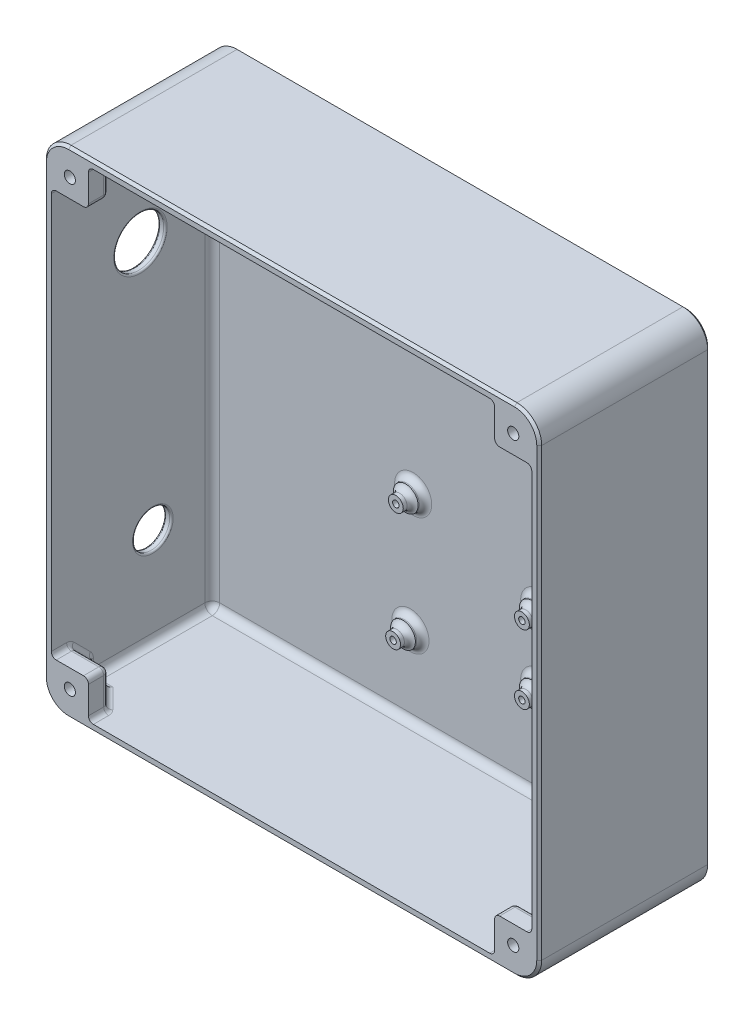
SolidWorks part; units mm, degrees
ref_plane "Ebene vorne" through (0, 0, 0) normal (0, 0, 1) x (1, 0, 0)
ref_plane "Ebene oben" through (0, 0, 0) normal (0, 1, 0) x (1, 0, 0)
ref_plane "Ebene rechts" through (0, 0, 0) normal (1, 0, 0) x (0, 0, -1)
sketch "Skizze1" plane through (0, 0, 0) normal (0, 0, 1) x (1, 0, 0)
  line L1 (-100, 100) -> (100, 100)
  line L2 (-100, 100) -> (-100, -100)
  line L3 (-100, -100) -> (100, -100)
  line L4 (100, 100) -> (100, -100)
  line L5 (-100, 100) -> (100, -100) construction
  line L6 (-100, -100) -> (100, 100) construction
  point P0 (0, 0)
  dimension "D1" = 200
  dimension "D2" = 200
extrude "Aufsatz-Linear austragen1" add sketch "Skizze1" along normal blind 4
sketch "Skizze2" plane through (0, 0, 4) normal (0, 0, 1) x (1, 0, 0)
  line L1 (-100, 100) -> (100, 100)
  line L2 (-100, 100) -> (-100, -100)
  line L3 (-100, -100) -> (100, -100)
  line L4 (100, 100) -> (100, -100)
  line L5 (-100, 100) -> (100, -100) construction
  line L6 (-100, -100) -> (100, 100) construction
  line L7 (-97, 97) -> (97, 97)
  line L8 (-97, 97) -> (-97, -97)
  line L9 (-97, -97) -> (97, -97)
  line L10 (97, 97) -> (97, -97)
  line L11 (-97, 97) -> (97, -97) construction
  line L12 (-97, -97) -> (97, 97) construction
  point P0 (0, 0)
  point P7 (0, 0)
  dimension "D1" = 194
extrude "Aufsatz-Linear austragen2" add sketch "Skizze2" along normal blind 65
sketch "Skizze6" plane through (0, 0, 4) normal (0, 0, 1) x (1, 0, 0)
  circle A0 centre (-15.9, -16.9) radius 3
  circle A1 centre (35, -32.2) radius 3
  circle A2 centre (-17, -65.1) radius 3
  circle A3 centre (35, -60) radius 3
  dimension "D1" = 6
  dimension "D2" = 50.9
  dimension "D3" = 52
  dimension "D4" = 27.8
  dimension "D5" = 48.2
  dimension "D6" = 15.3
  dimension "D7" = 35
  dimension "D8" = 60
extrude "Arduino Halterung" add sketch "Skizze6" along normal blind 7
sketch "Skizze11" plane through (0, 0, 69) normal (0, 0, 1) x (1, 0, 0)
  line L1 (-97, 97) -> (-82, 97)
  line L2 (-97, 97) -> (-97, 82)
  line L3 (-97, 82) -> (-82, 82)
  line L4 (-82, 97) -> (-82, 82)
  line L5 (-97, -97) -> (-82, -97)
  line L6 (-97, -97) -> (-97, -82)
  line L7 (-97, -82) -> (-82, -82)
  line L8 (-82, -97) -> (-82, -82)
  line L9 (97, -97) -> (82, -97)
  line L10 (97, -97) -> (97, -82)
  line L11 (97, -82) -> (82, -82)
  line L12 (82, -97) -> (82, -82)
  line L13 (97, 97) -> (82, 97)
  line L14 (97, 97) -> (97, 82)
  line L15 (97, 82) -> (82, 82)
  line L16 (82, 97) -> (82, 82)
  dimension "D1" = 15
extrude "Aufsatz Verbingung" add sketch "Skizze11" against normal blind 15
sketch "Skizze12" plane through (0, 0, 69) normal (0, 0, 1) x (1, 0, 0)
  line L0 (-82, 82) -> (-82, 97) construction
  line L1 (-97, 82) -> (-82, 82) construction
  line L2 (-82, -97) -> (-82, -82) construction
  line L3 (-82, -82) -> (-97, -82) construction
  line L4 (97, -82) -> (82, -82) construction
  line L5 (82, -82) -> (82, -97) construction
  line L6 (82, 97) -> (82, 82) construction
  line L7 (82, 82) -> (97, 82) construction
  circle A0 centre (-89.5, 89.5) radius 2.25
  circle A1 centre (89.5, 89.5) radius 2.25
  circle A2 centre (89.5, -89.5) radius 2.25
  circle A3 centre (-89.5, -89.5) radius 2.25
  dimension "D1" = 4.5
  dimension "D2" = 7.5
  dimension "D3" = 7.5
  dimension "D4" = 7.5
  dimension "D5" = 7.5
  dimension "D6" = 7.5
  dimension "D7" = 7.5
  dimension "D8" = 7.5
  dimension "D9" = 7.5
extrude "Bohrung Verbindung" cut sketch "Skizze12" against normal up to next
sketch "Skizze14" plane through (0, 0, 11) normal (0, 0, 1) x (1, 0, 0)
  circle A0 centre (-15.9, -16.9) radius 1.3
  circle A1 centre (35, -32.2) radius 1.3
  circle A2 centre (35, -60) radius 1.3
  circle A3 centre (-17, -65.1) radius 1.3
  circle A4 centre (-17, -65.1) radius 3 construction
  circle A7 centre (35, -60) radius 3 construction
  circle A8 centre (35, -32.2) radius 3 construction
  circle A9 centre (-15.9, -16.9) radius 3 construction
  dimension "D1" = 2.6
extrude "Bohrung für Arduino" cut sketch "Skizze14" against normal blind 6
sketch "Skizze15" plane through (0, 0, 54) normal (0, 0, -1) x (-1, 0, 0)
  line L0 (-97, 97) -> (-82, 97) construction
  line L1 (-91.5207, 86) -> (-87.4793, 86)
  line L2 (-87.4793, 86) -> (-85.4585, 89.5)
  line L3 (-85.4585, 89.5) -> (-87.4793, 93)
  line L4 (-87.4793, 93) -> (-91.5207, 93)
  line L5 (-91.5207, 93) -> (-93.5415, 89.5)
  line L6 (-93.5415, 89.5) -> (-91.5207, 86)
  line L7 (82, 97) -> (97, 97) construction
  line L8 (91.5207, 86) -> (93.5415, 89.5)
  line L9 (93.5415, 89.5) -> (91.5207, 93)
  line L10 (91.5207, 93) -> (87.4793, 93)
  line L11 (87.4793, 93) -> (85.4585, 89.5)
  line L12 (85.4585, 89.5) -> (87.4793, 86)
  line L13 (87.4793, 86) -> (91.5207, 86)
  line L14 (97, -97) -> (82, -97) construction
  line L15 (91.5207, -93) -> (93.5415, -89.5)
  line L16 (93.5415, -89.5) -> (91.5207, -86)
  line L17 (91.5207, -86) -> (87.4793, -86)
  line L18 (87.4793, -86) -> (85.4585, -89.5)
  line L19 (85.4585, -89.5) -> (87.4793, -93)
  line L20 (87.4793, -93) -> (91.5207, -93)
  line L21 (-82, -97) -> (-97, -97) construction
  line L22 (-87.4793, -93) -> (-85.4585, -89.5)
  line L23 (-85.4585, -89.5) -> (-87.4793, -86)
  line L24 (-87.4793, -86) -> (-91.5207, -86)
  line L25 (-91.5207, -86) -> (-93.5415, -89.5)
  line L26 (-93.5415, -89.5) -> (-91.5207, -93)
  line L27 (-91.5207, -93) -> (-87.4793, -93)
  circle A0 centre (-89.5, 89.5) radius 3.5 construction
  circle A1 centre (89.5, 89.5) radius 3.5 construction
  circle A2 centre (89.5, -89.5) radius 3.5 construction
  circle A3 centre (-89.5, -89.5) radius 3.5 construction
  dimension "D1" = 7
  dimension "D2" = 7
  dimension "D3" = 7
  dimension "D4" = 7
extrude "Innensechskant" cut sketch "Skizze15" against normal blind 10
chamfer "Fase Verbindung" distance 8 angle 45 8 edges at (82, -89.5, 54) (89.5, -82, 54) (-89.5, 82, 54) (-82, 89.5, 54) (-89.5, -82, 54) (-82, -89.5, 54) (82, 89.5, 54) (89.5, 82, 54)
fillet "Verrundung innen" radius 3 8 edges at (-97, 0, 4) (-97, -97, 29) (0, -97, 4) (97, -97, 29) (97, 0, 4) (97, 97, 29) (0, 97, 4) (-97, 97, 29)
fillet "Verrundung außen" radius 10 4 edges at (-100, -100, 34.5) (-100, 100, 34.5) (100, 100, 34.5) (100, -100, 34.5)
chamfer "Außen Fase" distance 1 angle 45 16 edges at (97.0711, -97.0711, 0) (100, 0, 0) (97.0711, 97.0711, 0) (0, 100, 0) (-97.0711, 97.0711, 0) (-100, 0, 0) (-97.0711, -97.0711, 0) (0, -100, 0) (97.0711, -97.0711, 69) (100, 0, 69) (0, -100, 69) (97.0711, 97.0711, 69) (-97.0711, -97.0711, 69) (0, 100, 69) (-100, 0, 69) (-97.0711, 97.0711, 69)
sketch "Sketch1" plane through (-100, 0, 0) normal (-1, 0, 0) x (0, 0, 1)
  line L0 (68, -90) -> (68, 90) construction
  line L1 (1, -90) -> (68, -90) construction
  line L2 (68, 90) -> (1, 90) construction
  circle A0 centre (28, -58) radius 7.5
  circle A1 centre (33, 45) radius 10.1
  dimension "D1" = 15
  dimension "D4" = 20.2
  dimension "D2" = 40
  dimension "D3" = 32
  dimension "D5" = 35
  dimension "D6" = 45
extrude "Taster und 9V Stecker" cut sketch "Sketch1" against normal blind 5
fillet "Taster und 9V Stecker Verrundung" radius 0.7 4 edges at (-100, 34.9, 33) (-97, 45, 22.9) (-100, -65.5, 28) (-97, -58, 20.5)
fillet "Fillet2" radius 2 12 edges at (-97, 92, 54) (-96.1213, 96.1213, 54) (-92, 97, 54) (-84.4689, 84.4689, 59.5311) (-82, 82, 65.5) (-82, 89.5, 62) (-89.5, 82, 62) (-90, 95, 54) (-86, 97, 58) (-82, 97, 65.5) (-97, 86, 58) (-97, 82, 65.5)
fillet "Fillet3" radius 2 10 edges at (92, 97, 54) (96.1213, 96.1213, 54) (97, 92, 54) (97, 86, 58) (86, 97, 58) (95.1264, 90, 54) (89.5, 82, 62) (97, 82, 65.5) (82, 89.5, 62) (82, 97, 65.5)
fillet "Fillet5" radius 2 10 edges at (-92, -97, 54) (-96.1213, -96.1213, 54) (-97, -92, 54) (-95.1264, -90, 54) (-89.5, -82, 62) (-82, -89.5, 62) (-86, -97, 58) (-82, -97, 65.5) (-97, -86, 58) (-97, -82, 65.5)
fillet "Fillet6" radius 2 8 edges at (-84.7618, -84.7618, 59.2382) (-82.1522, -82.1522, 62.0631) (-82, -82, 65.9142) (84.4689, -84.4689, 59.5311) (82, -82, 65.5) (84.7618, 84.7618, 59.2382) (82.1522, 82.1522, 62.0631) (82, 82, 65.9142)
fillet "Fillet7" radius 2 11 edges at (97, -92, 54) (96.1213, -96.1213, 54) (92, -97, 54) (90, -95, 54) (90.5, -82, 62) (97, -86, 58) (97, -82, 65.5) (82, -90.5, 62) (86, -97, 58) (82, -97, 65.5) (82.5858, -82.5858, 61.7932)
sketch "Sketch3" plane through (0, 0, 4) normal (0, 0, 1) x (1, 0, 0)
  circle A0 centre (-15.9, -16.9) radius 5
  circle A1 centre (35, -32.2) radius 5
  circle A2 centre (35, -60) radius 5
  circle A3 centre (-17, -65.1) radius 5
  dimension "D1" = 10
  dimension "D2" = 10
  dimension "D3" = 10
  dimension "D4" = 10
extrude "Arduino Bohrung Hilfe" add sketch "Sketch3" along normal blind 3
fillet "Fillet11" radius 2.5 4 edges at (-10.9, -16.9, 4) (-12, -65.1, 4) (40, -60, 4) (40, -32.2, 4)
fillet "Fillet12" radius 2.5 4 edges at (-12.9, -16.9, 7) (-14, -65.1, 7) (38, -60, 7) (38, -32.2, 7)
